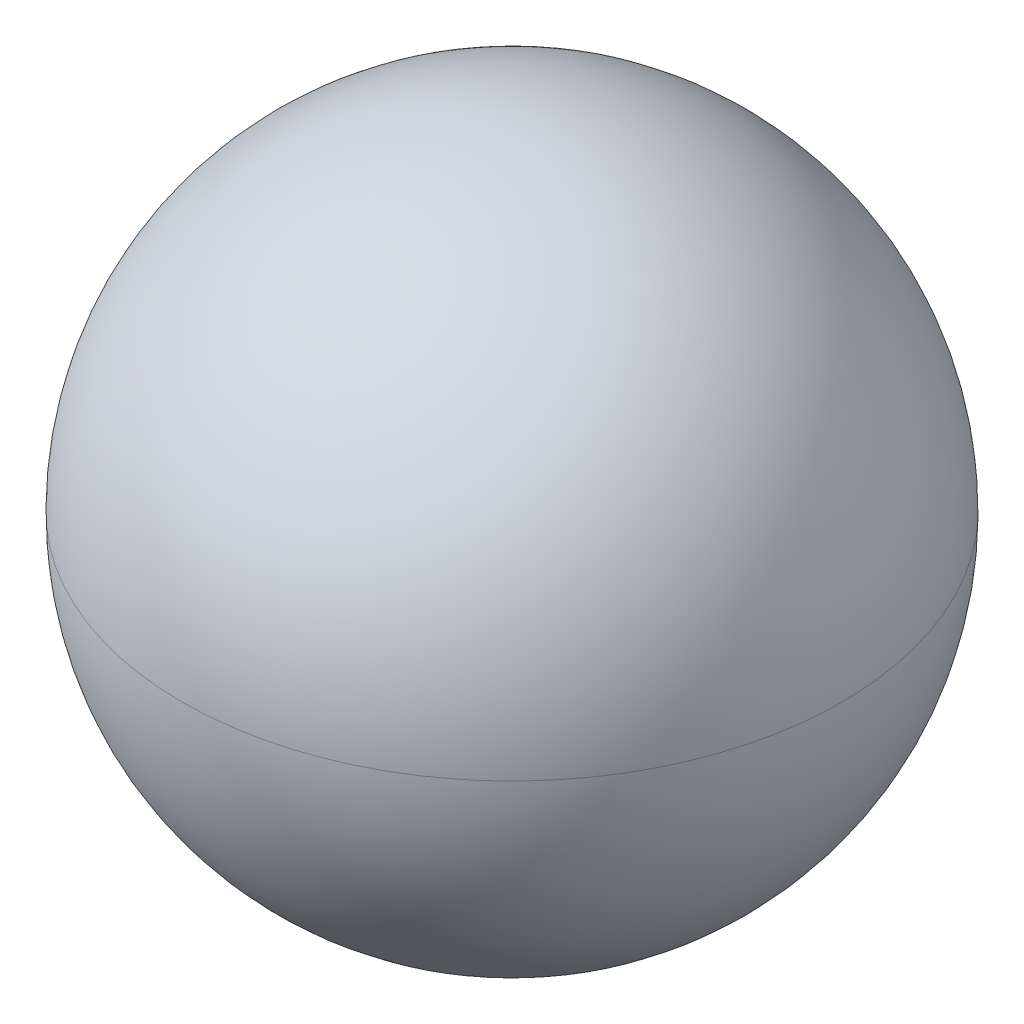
SolidWorks part; units mm, degrees
ref_plane "Plan de face" through (0, 0, 0) normal (0, 0, 1) x (1, 0, 0)
ref_plane "Plan de dessus" through (0, 0, 0) normal (0, 1, 0) x (1, 0, 0)
ref_plane "Plan de droite" through (0, 0, 0) normal (1, 0, 0) x (0, 0, -1)
sketch "Esquisse1" plane through (0, 0, 0) normal (0, 1, 0) x (1, 0, 0)
  circle A0 centre (0, 0) radius 20
  dimension "D1" = 40
extrude "Boss.-Extru.1" add sketch "Esquisse1" along normal blind 40
fillet "Congé1" radius 20 2 edges at (0, 0, 20) (0, 40, 20)
